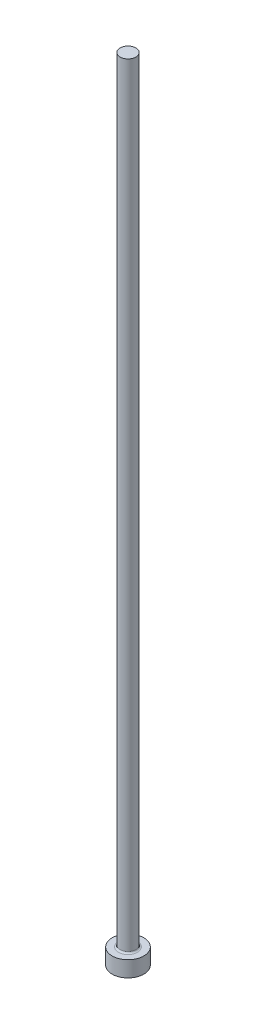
SolidWorks part; units mm, degrees
ref_plane "Plano frontal" through (0, 0, 0) normal (0, 0, 1) x (1, 0, 0)
ref_plane "Plano superior" through (0, 0, 0) normal (0, 1, 0) x (1, 0, 0)
ref_plane "Plano direito" through (0, 0, 0) normal (1, 0, 0) x (0, 0, -1)
sketch "Esboço1" plane through (0, 0, 0) normal (0, 0, 1) x (1, 0, 0)
  line L0 (0, 0) -> (2, 0)
  line L1 (2, 0) -> (2, 2)
  line L2 (2, 2) -> (1.2, 2)
  line L3 (1, 2.2) -> (1, 100)
  line L4 (1, 100) -> (0, 100)
  line L5 (0, 100) -> (0, 0) construction
  line L6 (0, 0) -> (0, 100)
  arc A0 (1.2, 2) -> (1, 2.2) centre (1.2, 2.2) cw
  dimension "D3" = 0.2
  dimension "D1" = 4
  dimension "D2" = 2
  dimension "D4" = 2
  dimension "D5" = 100
revolve "Revolução1" add sketch "Esboço1" angle 360 about L5
sketch "Esboço2"
  dimension "D1" = 1.075
  dimension "D2" = 0.35
  dimension "D3" = 0.225
  dimension "D4" = 0.15
wrap "Envolver1" sketch "Esboço2" wrap type deboss source sketch "Esboço2" thickness 0.1 parameters "D1"=0.1
